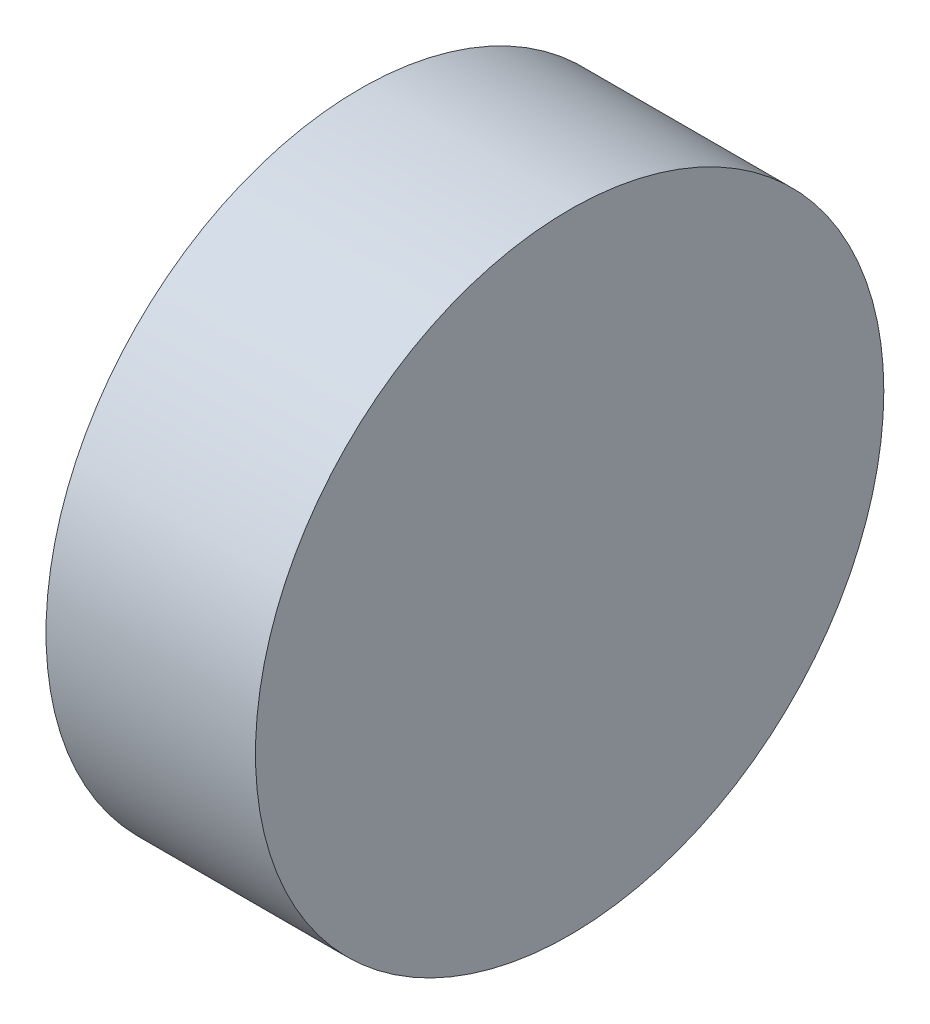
SolidWorks part; units mm, degrees
ref_plane "Front Plane" through (0, 0, 0) normal (0, 0, 1) x (1, 0, 0)
ref_plane "Top Plane" through (0, 0, 0) normal (0, 1, 0) x (1, 0, 0)
ref_plane "Right Plane" through (0, 0, 0) normal (1, 0, 0) x (0, 0, -1)
sketch "Sketch1" plane through (0, 0, 0) normal (1, 0, 0) x (0, 0, -1)
  circle A0 centre (0, 0) radius 45
  dimension "D1" = 90
extrude "Boss-Extrude1" add sketch "Sketch1" along normal blind 30
